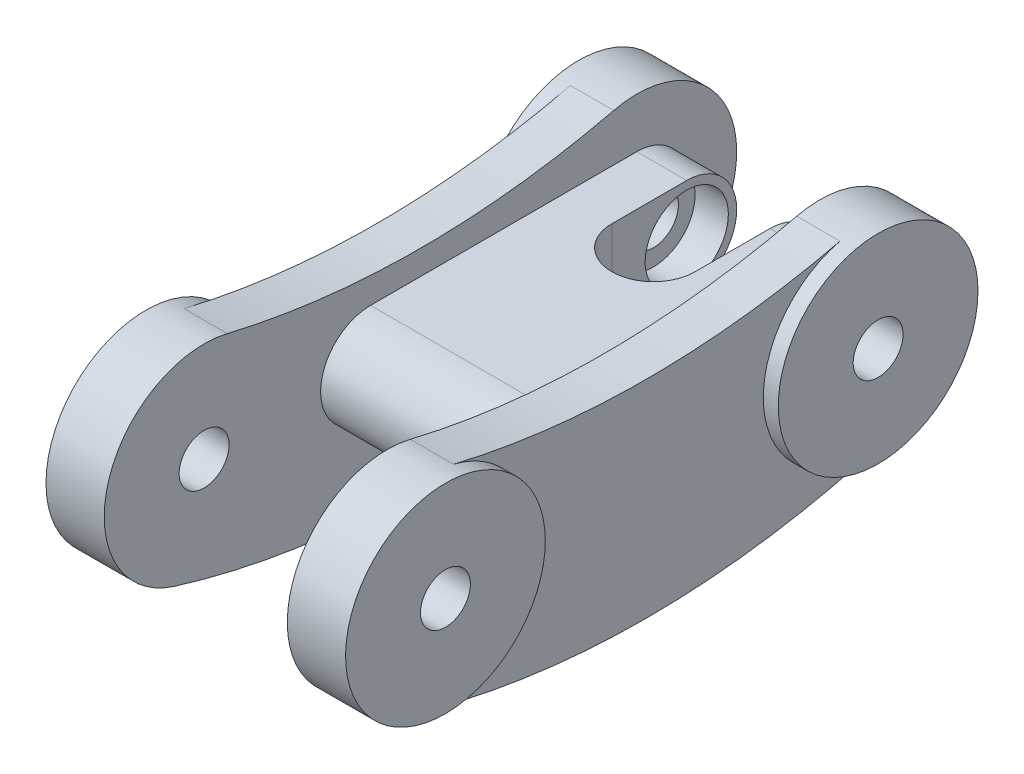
SolidWorks part; units mm, degrees
ref_plane "Front Plane" through (0, 0, 0) normal (0, 0, 1) x (1, 0, 0)
ref_plane "Top Plane" through (0, 0, 0) normal (0, 1, 0) x (1, 0, 0)
ref_plane "Right Plane" through (0, 0, 0) normal (1, 0, 0) x (0, 0, -1)
sketch "Sketch1" plane through (0, 0, 0) normal (1, 0, 0) x (0, 0, -1)
  line L1 (-16.51, 7.62) -> (16.51, 7.62)
  line L2 (-16.51, 7.62) -> (-16.51, -7.62)
  line L3 (-16.51, -7.62) -> (16.51, -7.62)
  line L4 (16.51, 7.62) -> (16.51, -7.62)
  circle A0 centre (16.51, 0) radius 7.62
  circle A1 centre (-16.51, 0) radius 7.62
  circle A2 centre (0, 69.1771) radius 63.5
  circle A3 centre (0, 53.3853) radius 63.5
  dimension "D5" = 127
  dimension "D6" = 127
  dimension "D1" = 15.24
  dimension "D2" = 7.62
  dimension "D3" = 33.02
  dimension "D4" = 16.51
extrude "Boss-Extrude1" add sketch "Sketch1" along normal blind 3.302 contours L2 A1 | L2 A1 | A2 A1 L3 A0 | L4 A0 | L4 A0 | A1 A3 A0 L3
sketch "Sketch2" plane through (3.302, 0, 0) normal (1, 0, 0) x (0, 0, -1)
  circle A0 centre (16.51, 0) radius 1.905
  arc A1 (18.7614, -7.2798) -> (14.7411, 7.4118) centre (16.51, 0) ccw construction
  circle A2 centre (-16.51, 0) radius 1.905
  arc A3 (-14.7411, 7.4118) -> (-18.7614, -7.2798) centre (-16.51, 0) ccw construction
  dimension "D1" = 3.81
  dimension "D2" = 3.81
extrude "Cut-Extrude1" cut sketch "Sketch2" against normal blind 3.302
sketch "Sketch3" plane through (3.302, 0, 0) normal (1, 0, 0) x (0, 0, -1)
  line L1 (16.51, 3.81) -> (-3.81, 3.81)
  line L2 (16.51, 3.81) -> (16.51, -3.81)
  line L3 (16.51, -3.81) -> (-3.81, -3.81)
  line L4 (-3.81, 3.81) -> (-3.81, -3.81)
  circle A0 centre (16.51, 0) radius 3.81
  circle A1 centre (-3.81, 0) radius 3.81
  dimension "D1" = 7.62
  dimension "D2" = 7.62
  dimension "D3" = 20.32
extrude "Boss-Extrude2" add sketch "Sketch3" along normal blind 13.97 contours A1 L3 A0 L1 | L4 A1 | L4 A1 | L2 A0 M2 | L2 A0 M2
sketch "Sketch6" plane through (17.272, 0, 0) normal (1, 0, 0) x (0, 0, -1)
  circle A0 centre (16.51, 0) radius 1.905
  circle A1 centre (-16.51, 0) radius 1.905
  arc A4 (-14.7411, 7.4118) -> (14.7411, 7.4118) centre (0, 69.1771) ccw
  arc A5 (-14.7411, 7.4118) -> (-18.7614, -7.2798) centre (-16.51, 0) ccw
  arc A6 (-18.7614, -7.2798) -> (18.7614, -7.2798) centre (0, 53.3853) ccw
  arc A7 (18.7614, -7.2798) -> (14.7411, 7.4118) centre (16.51, 0) ccw
  arc A8 (-14.7411, 7.4118) -> (14.7411, 7.4118) centre (0, 69.1771) ccw
  arc A9 (-14.7411, 7.4118) -> (-18.7614, -7.2798) centre (-16.51, 0) ccw
  arc A10 (-18.7614, -7.2798) -> (18.7614, -7.2798) centre (0, 53.3853) ccw
  arc A11 (18.7614, -7.2798) -> (14.7411, 7.4118) centre (16.51, 0) ccw
  dimension "D2" = 3.81
  dimension "D3" = 3.81
  dimension "D1" = 0
extrude "Boss-Extrude3" add sketch "Sketch6" along normal blind 3.302
sketch "Sketch7" plane through (0, 3.81, 0) normal (0, 1, 0) x (1, 0, 0)
  line L0 (17.272, 20.32) -> (3.302, 20.32) construction
  line L1 (7.112, 20.32) -> (13.462, 20.32)
  line L2 (7.112, 20.32) -> (7.112, 10.795)
  line L3 (7.112, 10.795) -> (13.462, 10.795)
  line L4 (13.462, 20.32) -> (13.462, 10.795)
  line L5 (3.302, -14.7411) -> (3.302, 14.7411) construction
  circle A0 centre (10.287, 10.795) radius 3.175
  dimension "D1" = 6.35
  dimension "D2" = 9.525
  dimension "D3" = 6.985
extrude "Cut-Extrude2" cut sketch "Sketch7" against normal blind 12.7 contours A0 L4 L2 M4 | L4 L1 L2 M4 | L3 A0 | L3 A0
ref_plane "Plane1" through (0, 0, -10.16) normal (0, 0, 1) x (1, 0, 0)
sketch "Sketch8" plane through (0, 0, -10.16) normal (0, 0, 1) x (1, 0, 0)
  circle A0 centre (10.16, 0) radius 0.9525
  dimension "D1" = 1.905
  dimension "D2" = 10.16
extrude "Cut-Extrude3" cut sketch "Sketch8" along normal blind 7.62
sketch "Sketch9" plane through (7.112, 0, 0) normal (1, 0, 0) x (0, 0, -1)
  circle A0 centre (16.51, 0) radius 3.175
  dimension "D1" = 6.35
extrude "Cut-Extrude4" cut sketch "Sketch9" against normal blind 2.54
sketch "Sketch10" plane through (13.462, 0, 0) normal (-1, 0, 0) x (0, 0, 1)
  circle A0 centre (-16.51, 0) radius 3.175
  dimension "D1" = 6.35
extrude "Cut-Extrude5" cut sketch "Sketch10" against normal blind 2.54
ref_plane "Plane2" through (0, 7.4118, -14.7411) normal (0, 0.2321, -0.9727) x (-1, 0, 0)
sketch "Sketch12" plane through (0, 0, 0) normal (-1, 0, 0) x (0, 0, 1)
  circle A0 centre (-16.51, 0) radius 7.62
  circle A1 centre (-16.51, 0) radius 1.905
  dimension "D1" = 15.24
  dimension "D2" = 3.81
extrude "Boss-Extrude4" add sketch "Sketch12" along normal blind 1.143
sketch "Sketch13" plane through (20.574, 0, 0) normal (1, 0, 0) x (0, 0, -1)
  circle A0 centre (16.51, 0) radius 7.62
  circle A1 centre (16.51, 0) radius 1.905
  dimension "D1" = 15.24
  dimension "D2" = 3.81
extrude "Boss-Extrude5" add sketch "Sketch13" along normal blind 1.143
sketch "Sketch14" plane through (20.574, 0, 0) normal (1, 0, 0) x (0, 0, -1)
  circle A0 centre (-16.51, 0) radius 1.905
  circle A1 centre (-16.51, 0) radius 7.62
  dimension "D1" = 15.24
  dimension "D2" = 3.81
extrude "Boss-Extrude6" add sketch "Sketch14" along normal blind 1.143
sketch "Sketch15" plane through (0, 0, 0) normal (-1, 0, 0) x (0, 0, 1)
  circle A0 centre (16.51, 0) radius 1.905
  circle A1 centre (16.51, 0) radius 7.62
  dimension "D1" = 15.24
  dimension "D2" = 3.81
extrude "Boss-Extrude7" add sketch "Sketch15" along normal blind 1.143
